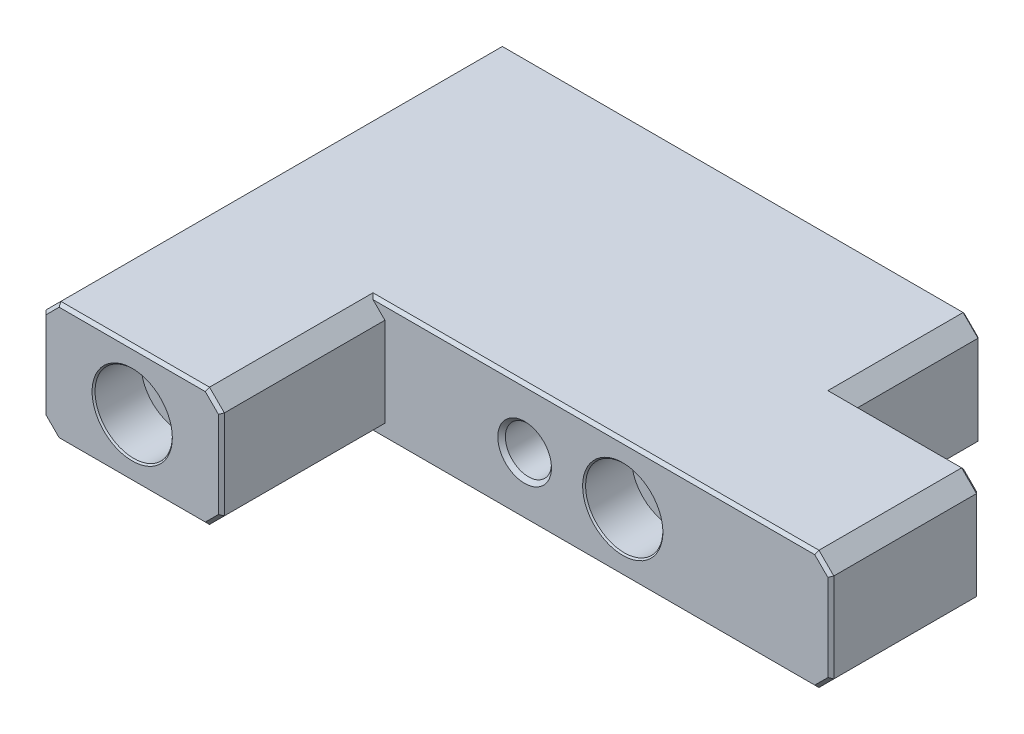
SolidWorks part; units mm, degrees
ref_plane "Plan de face" through (0, 0, 0) normal (0, 0, 1) x (1, 0, 0)
ref_plane "Plan de dessus" through (0, 0, 0) normal (0, 1, 0) x (1, 0, 0)
ref_plane "Plan de droite" through (0, 0, 0) normal (1, 0, 0) x (0, 0, -1)
sketch "Esquisse1" plane through (0, 0, 0) normal (0, 0, 1) x (1, 0, 0)
  line L0 (0, 40) -> (0, 0)
  line L1 (0, 0) -> (210, 0)
  line L2 (210, 0) -> (210, 40)
  line L3 (210, 40) -> (0, 40)
  dimension "D1" = 210
  dimension "D2" = 40
extrude "Volume" add sketch "Esquisse1" along normal blind 150
sketch "Esquisse5" plane through (0, 40, 0) normal (0, 1, 0) x (1, 0, 0)
  line L0 (0, -150) -> (0, 0) construction
  line L1 (230, -170) -> (60, -170)
  line L2 (230, -170) -> (230, -95)
  line L3 (230, -95) -> (60, -95)
  line L4 (60, -170) -> (60, -95)
  line L5 (210, 0) -> (0, 0) construction
  line L6 (210, -150) -> (0, -150) construction
  line L7 (210, -150) -> (210, 0) construction
  line L9 (165, 25) -> (230, 25)
  line L10 (165, 25) -> (165, -45)
  line L11 (165, -45) -> (230, -45)
  line L12 (230, 25) -> (230, -45)
  dimension "D1" = 60
  dimension "D2" = 95
  dimension "D3" = 20
  dimension "D4" = 20
  dimension "D5" = 45
  dimension "D6" = 25
  dimension "D7" = 20
  dimension "D8" = 165
extrude "Enlèv. mat.-Extru.1" cut sketch "Esquisse5" against normal through all
sketch "Position lamage 1 - Vis CHc M16" plane through (0, 0, 150) normal (0, 0, 1) x (1, 0, 0)
  line L0 (0, 0) -> (60, 0) construction
  line L1 (0, 40) -> (0, 0) construction
  point P0 (30, 20)
  dimension "D1" = 20
  dimension "D2" = 30
sketch "Position lamage 2 - Vis CHc M16" plane through (0, 0, 95) normal (0, 0, 1) x (1, 0, 0)
  line L0 (210, 0) -> (60, 0) construction
  line L1 (210, 40) -> (210, 0) construction
  point P0 (140, 20)
  dimension "D1" = 20
  dimension "D2" = 110
  dimension "D3" = 70
hole_wizard "Lamage vis M16" positions "Esquisse3D4" profile "Esquisse8" counterbore size "M16" standard "ISO"
sketch3d "Esquisse3D4"
  point P0 (30, 20, 150)
  point P3 (140, 20, 95)
sketch "Esquisse8" plane through (30, 20, 150) normal (1, 0, 0) x (0, -1, 0)
  line L0 (0, 0) -> (0, 150)
  line L1 (0, 150) -> (8.75, 150)
  line L3 (8.75, 150) -> (8.75, 16)
  line L4 (8.75, 16) -> (13, 16)
  line L5 (13, 16) -> (13, 0)
  line L7 (13, 0) -> (0, 0)
  line L11 (0, -6.35) -> (0, 107.95) construction
  dimension "Diamètre du perçage jusqu'au prochain" = 17.5
  dimension "Profondeur du perçage jusqu'au prochain" = 150
  dimension "Diamètre du chambrage" = 26
  dimension "Profondeur du chambrage" = 16
sketch "Position taraudage M16" plane through (0, 0, 95) normal (0, 0, 1) x (1, 0, 0)
  point P0 (107, 20)
  dimension "D1" = 77
hole_wizard "Trou taraudé M18" positions "Esquisse3D5" profile "Esquisse10" tap size "M18" standard "DIN"
sketch3d "Esquisse3D5"
  point P0 (107, 20, 95)
sketch "Esquisse10" plane through (107, 20, 95) normal (1, 0, 0) x (0, -1, 0)
  line L0 (0, 0) -> (0, 53.1567)
  line L1 (0, 53.1567) -> (7.75, 48.5)
  line L2 (7.75, 48.5) -> (7.75, 1.275)
  line L3 (7.75, 1.275) -> (9.025, 0)
  line L5 (9.025, 0) -> (0, 0)
  line L6 (-7.75, 1.275) -> (-9.025, 0) construction
  line L10 (0, 53.1567) -> (-7.75, 48.5) construction
  line L11 (0, -6.35) -> (0, 107.95) construction
  dimension "Diamètre du trou pour taraudage" = 15.5
  dimension "Profondeur du trou pour taraudage" = 48.5
  dimension "Diamètre du fraisage entrant" = 18.05
  dimension "Angle du fraisage entrant" = 90
  dimension "Angle de pointe" = 118
sketch "Position M16 - Butée" plane through (0, 0, 0) normal (0, -1, 0) x (1, 0, 0)
  line L0 (0, 150) -> (0, 0) construction
  line L1 (0, 0) -> (165, 0) construction
  point P0 (190, 70)
  dimension "D1" = 190
  dimension "D2" = 70
hole_wizard "Trou taraudé M16 - Butée" positions "Esquisse13" profile "Esquisse12" tap size "M16" standard "DIN"
sketch "Esquisse13" plane through (0, 0, 0) normal (0, -1, 0) x (1, 0, 0)
  point P0 (190, 70)
sketch "Esquisse12" plane through (190, 0, 70) normal (1, 0, 0) x (0, 0, -1)
  line L0 (0, 0) -> (0, 29.206)
  line L1 (0, 29.206) -> (7, 25)
  line L2 (7, 25) -> (7, 1.025)
  line L3 (7, 1.025) -> (8.025, 0)
  line L5 (8.025, 0) -> (0, 0)
  line L6 (-7, 1.025) -> (-8.025, 0) construction
  line L10 (0, 29.206) -> (-7, 25) construction
  line L11 (0, -6.35) -> (0, 107.95) construction
  dimension "Diamètre du trou pour taraudage" = 14
  dimension "Profondeur du trou pour taraudage" = 25
  dimension "Diamètre du fraisage entrant" = 16.05
  dimension "Angle du fraisage entrant" = 90
  dimension "Angle de pointe" = 118
chamfer "Chanfreins 5mm" distance 5 angle 45 8 edges at (210, 0, 70) (210, 40, 70) (60, 40, 122.5) (60, 0, 122.5) (0, 0, 75) (0, 40, 75) (165, 0, 22.5) (165, 40, 22.5)
chamfer "Chanfreins 1mm" distance 1 angle 45 18 edges at (130, 0, 95) (207.5, 2.5, 95) (210, 20, 95) (207.5, 37.5, 95) (130, 40, 95) (2.5, 37.5, 150) (30, 40, 150) (57.5, 37.5, 150) (60, 20, 150) (57.5, 2.5, 150) (30, 0, 150) (2.5, 2.5, 150) (0, 20, 150) (182.5, 0, 45) (182.5, 40, 45) (207.5, 2.5, 45) (210, 20, 45) (207.5, 37.5, 45)
chamfer "Chanfreins 0.5mm" distance 0.5 angle 45 12 edges at (82.5, 40, 0) (2.5, 37.5, 0) (0, 20, 0) (2.5, 2.5, 0) (82.5, 0, 0) (140, 11.25, 0) (38.75, 20, 0) (140, 7, 95) (43, 20, 150) (165, 20, 0) (162.5, 37.5, 0) (162.5, 2.5, 0)
